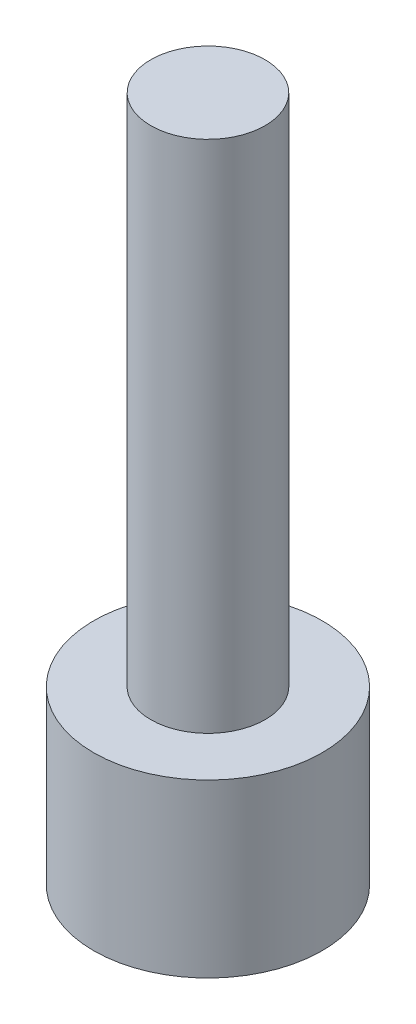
SolidWorks part; units mm, degrees
ref_plane "Plan de face" through (0, 0, 0) normal (0, 0, 1) x (1, 0, 0)
ref_plane "Plan de dessus" through (0, 0, 0) normal (0, 1, 0) x (1, 0, 0)
ref_plane "Plan de droite" through (0, 0, 0) normal (1, 0, 0) x (0, 0, -1)
sketch "Esquisse1" plane through (0, 0, 0) normal (0, 1, 0) x (1, 0, 0)
  circle A0 centre (0, 0) radius 2
  dimension "D1" = 4
extrude "Extrusion1" add sketch "Esquisse1" along normal blind 3
sketch "Esquisse2" plane through (0, 3, 0) normal (0, 1, 0) x (-1, 0, 0)
  circle A0 centre (0, 0) radius 1
  dimension "D1" = 2
extrude "Extrusion2" add sketch "Esquisse2" along normal blind 9
